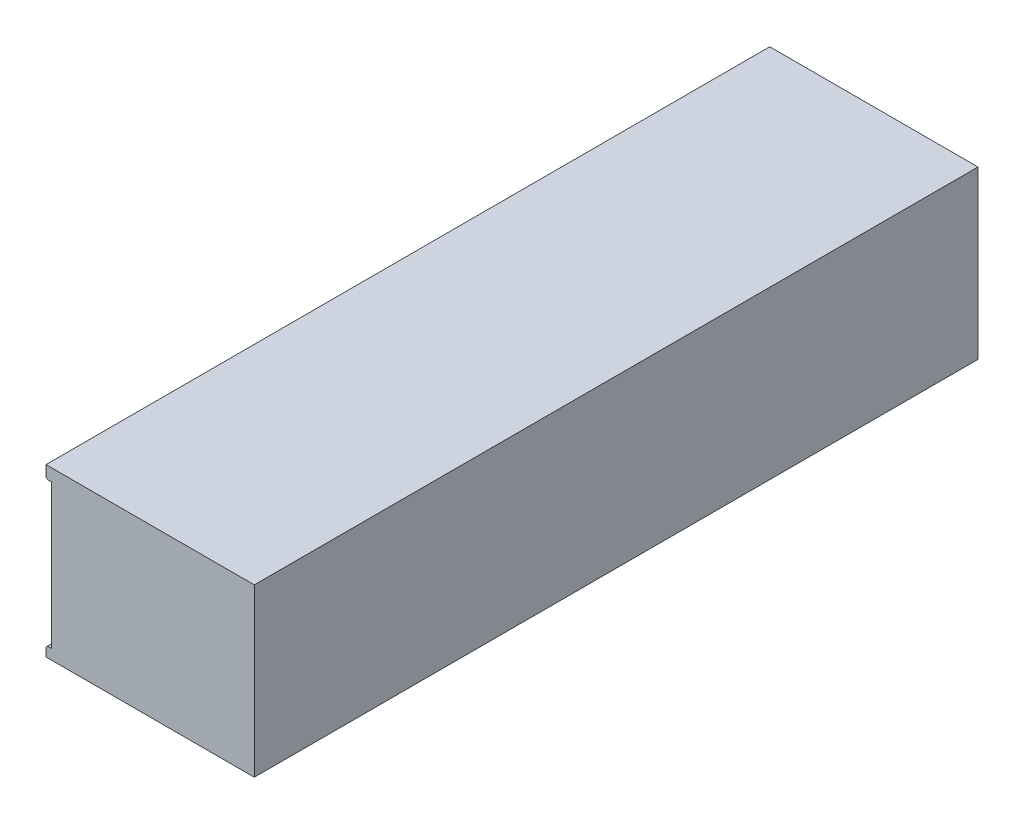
SolidWorks part; units mm, degrees
ref_plane "FRONT" through (0, 0, 0) normal (0, 0, 1) x (1, 0, 0)
ref_plane "TOP" through (0, 0, 0) normal (0, 1, 0) x (1, 0, 0)
ref_plane "RIGHT" through (0, 0, 0) normal (1, 0, 0) x (0, 0, -1)
sketch "Sketch1" plane through (0, 0, 0) normal (0, 0, 1) x (1, 0, 0)
  line L0 (50.673, 0) -> (50.673, -41.656)
  line L1 (50.673, -41.656) -> (-1.397, -41.656)
  line L2 (-1.397, -41.656) -> (-1.397, -39.116)
  line L3 (-1.397, -39.116) -> (0, -39.116)
  line L4 (0, -39.116) -> (0, -3.048)
  line L5 (0, -3.048) -> (-1.397, -3.048)
  line L6 (-1.397, -3.048) -> (-1.397, 0)
  line L7 (-1.397, 0) -> (50.673, 0)
  dimension "D1" = 52.07
  dimension "D2" = 50.673
  dimension "D3" = 3.048
  dimension "D4" = 2.54
  dimension "D5" = 41.656
extrude "Extrude1" add sketch "Sketch1" along normal mid plane 180.9496
sketch "Sketch2" plane through (0, 0, 0) normal (-1, 0, 0) x (0, 0, 1)
  line L1 (0, 0) -> (0, -41.656) construction
  line L2 (90.4748, -41.656) -> (-90.4748, -41.656) construction
  line L3 (0, -20.828) -> (26.0126, -20.828) construction
  point P0 (-85.598, -6.35)
  point P1 (85.598, -6.35)
  point P2 (4.8768, -6.35)
  point P4 (-4.8768, -6.35)
  point P9 (-4.8768, -35.814)
  point P12 (4.8768, -35.814)
  point P13 (85.598, -35.814)
  point P18 (-85.598, -35.814)
  dimension "D1" = 85.598
  dimension "D2" = 85.598
  dimension "D3" = 4.8768
  dimension "D4" = 14.478
  dimension "D5" = 14.986
hole_wizard "#10-32 Tapped Hole1" positions "3DSketch1" profile "Sketch3" tap size "#10-32" standard "Ansi Inch"
sketch3d "3DSketch1"
  point P0 (0, -6.35, -85.598)
  point P3 (0, -6.35, 85.598)
  point P6 (0, -6.35, 4.8768)
  point P9 (0, -6.35, -4.8768)
  point P12 (0, -35.814, -85.598)
  point P15 (0, -35.814, -4.8768)
  point P18 (0, -35.814, 4.8768)
  point P21 (0, -35.814, 85.598)
sketch "Sketch3" plane through (0, -6.35, -85.598) normal (0, 1, 0) x (0, 0, 1)
  line L0 (0, 0) -> (0, 11.2108)
  line L1 (0, 11.2108) -> (2.0193, 9.9974)
  line L2 (2.0193, 9.9974) -> (2.0193, 7.62)
  line L3 (2.0193, 7.62) -> (2.413, 7.62)
  line L4 (2.413, 7.62) -> (2.413, 0)
  line L5 (2.413, 0) -> (0, 0)
  line L10 (0, 11.2108) -> (-2.0193, 9.9974) construction
  line L11 (0, -6.35) -> (0, 107.95) construction
  dimension "Tap Drill Dia." = 4.0386
  dimension "Tap Drill Depth" = 9.9974
  dimension "Thread Major Dia." = 4.826
  dimension "Thread Depth" = 7.62
  dimension "Drill Angle" = 118
chamfer "Chamfer1" distance 0.381 angle 45 2 edges at (-1.397, -39.116, 0) (-1.397, -3.048, 0)
